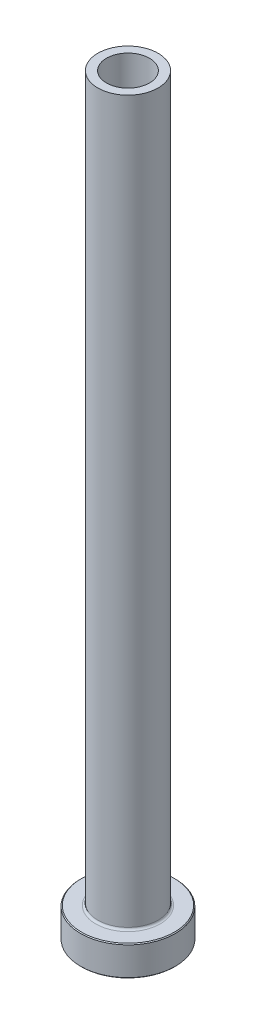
SolidWorks part; units mm, degrees
ref_plane "Front Plane" through (0, 0, 0) normal (0, 0, 1) x (1, 0, 0)
ref_plane "Top Plane" through (0, 0, 0) normal (0, 1, 0) x (1, 0, 0)
ref_plane "Right Plane" through (0, 0, 0) normal (1, 0, 0) x (0, 0, -1)
sketch "Sketch1" plane through (0, 0, 0) normal (0, 0, 1) x (1, 0, 0)
  line L0 (-5, 175) -> (-7, 175)
  line L1 (-7, 175) -> (-7, 7)
  line L2 (-7, 7) -> (-11, 7)
  line L3 (-11, 7) -> (-11, 0)
  line L4 (12.1, 0) -> (-12.1, 0) construction
  line L5 (-11, 0) -> (-5.25, 0)
  line L6 (-5, 130) -> (-5, 175)
  line L7 (0, 92.1877) -> (0, -15.5353) construction
  line L8 (0, -12.1) -> (0, 12.1) construction
  line L9 (-5, 130) -> (-5.25, 118)
  line L10 (-5.25, 118) -> (-5.25, 0)
  dimension "D1" = 0.25
  dimension "ID" = 10
  dimension "OD" = 14
  dimension "L" = 175
  dimension "H" = 22
  dimension "T" = 7
  dimension "N" = 45
  dimension "D2" = 12
revolve "Revolve1" add sketch "Sketch1" angle 360 about L7
fillet "Fillet1" radius 0.5 1 edges at (0, 7, 7)
chamfer "Chamfer1" distance 0.2 angle 45 2 edges at (0, 7, 11) (0, 0, 11)
chamfer "Chamfer3" distance 0.5 angle 45 1 edges at (0, 0, 5.25)
